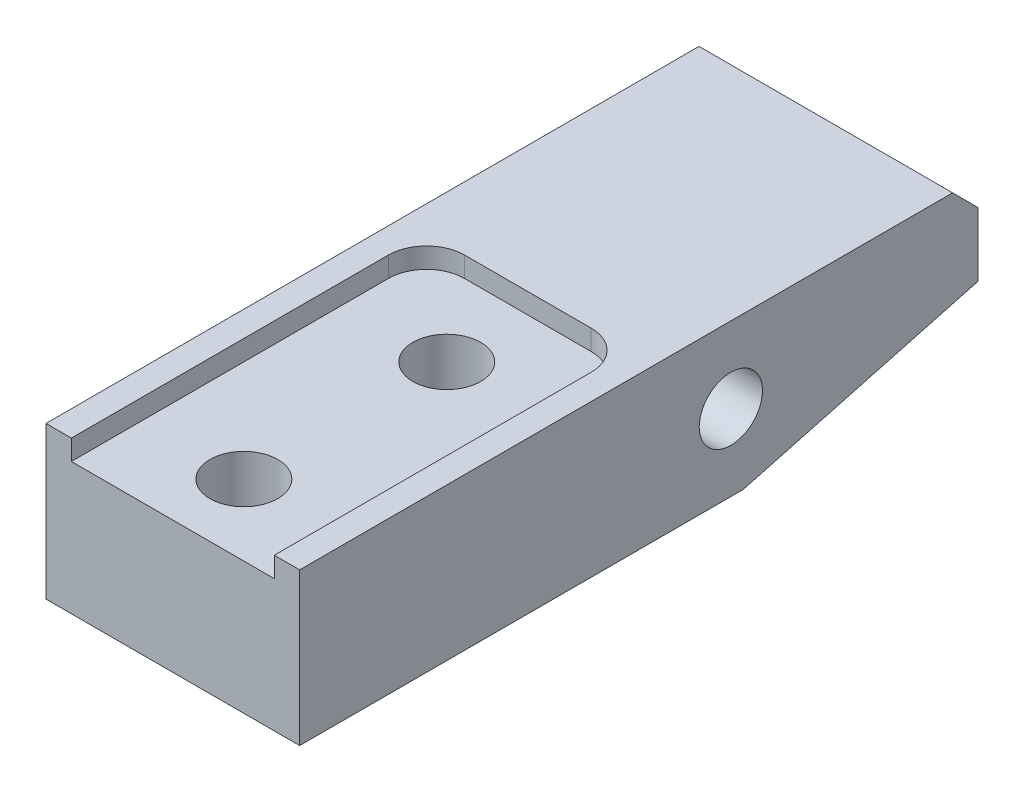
SolidWorks part; units mm, degrees
ref_plane "Front/Back" through (0, 0, 0) normal (0, 0, 1) x (1, 0, 0)
ref_plane "Top/Bottom" through (0, 0, 0) normal (0, 1, 0) x (1, 0, 0)
ref_plane "Right/Left" through (0, 0, 0) normal (1, 0, 0) x (0, 0, -1)
sketch "Sketch1" plane through (0, 0, 0) normal (0, 1, 0) x (1, 0, 0)
  line L0 (0, 0) -> (15.875, 0) construction
  line L1 (-15.875, 42.4561) -> (15.875, 42.4561)
  line L2 (-15.875, 42.4561) -> (-15.875, -42.4561)
  line L3 (-15.875, -42.4561) -> (15.875, -42.4561)
  line L4 (15.875, 42.4561) -> (15.875, -42.4561)
  line L5 (0, 0) -> (0, 42.4561) construction
  dimension "D1" = 31.75
  dimension "D2" = 84.9122
extrude "Extrude1" add sketch "Sketch1" along normal mid plane 19.05
sketch "Sketch2" plane through (0, 9.525, 0) normal (0, 1, 0) x (-1, 0, 0)
  line L0 (0, 0) -> (0, 47.0816) construction
  line L1 (0, 0) -> (18.9167, 0) construction
  line L2 (15.875, 42.4561) -> (-15.875, 42.4561) construction
  line L3 (-12.7, 42.4561) -> (12.7, 42.4561)
  line L4 (-12.7, 42.4561) -> (-12.7, -1.9939)
  line L5 (-12.7, -1.9939) -> (12.7, -1.9939)
  line L6 (12.7, 42.4561) -> (12.7, -1.9939)
  dimension "D1" = 25.4
  dimension "D2" = 44.45
extrude "(Key Pocket)" cut sketch "Sketch2" against normal blind 2.54
fillet "Fillet1" radius 4.7752 2 edges at (12.7, 8.255, -1.9939) (-12.7, 8.255, -1.9939)
hole_wizard "M10 X 1.5 Thru (Mount Holes)" positions "Sketch4" profile "Sketch3" tap size "M10x1.5" standard "Ansi Metric"
sketch "Sketch4" plane through (0, 6.985, 0) normal (0, 1, 0) x (-1, 0, 0)
  line L0 (0, 0) -> (0, 44.9974) construction
  line L1 (0, 0) -> (29.0657, 0) construction
  line L2 (12.7, 42.4561) -> (-12.7, 42.4561) construction
  point P0 (0, 8.1661)
  point P1 (0, 33.5661)
  dimension "D1" = 25.4
  dimension "D2" = 8.89
sketch "Sketch3" plane through (0, 6.985, 8.1661) normal (1, 0, 0) x (0, 0, 1)
  line L0 (0, 0) -> (0, 16.51)
  line L1 (0, 16.51) -> (4.25, 16.51)
  line L2 (4.25, 16.51) -> (4.25, 0)
  line L5 (4.25, 0) -> (0, 0)
  line L11 (0, -6.35) -> (0, 107.95) construction
  dimension "Thru Tap Drill Dia." = 8.5
  dimension "Thru Tap Drill Depth" = 16.51
sketch "Sketch6" plane through (-15.875, 0, 0) normal (-1, 0, 0) x (0, 0, 1)
  line L0 (0, 0) -> (45.1599, 0) construction
  line L1 (0, 0) -> (0, 18.5564) construction
  line L2 (42.4561, 9.525) -> (42.4561, -9.525) construction
  circle A0 centre (-11.5189, 0) radius 3.9624
  dimension "D1" = 7.9248
  dimension "D2" = 53.975
extrude "Cut-Extrude2" cut sketch "Sketch6" against normal through all
sketch "Sketch7" plane through (-15.875, 0, 0) normal (-1, 0, 0) x (0, 0, 1)
  line L0 (-13.0699, -9.525) -> (-42.4561, -1.651)
  line L1 (-42.4561, -9.525) -> (42.4561, -9.525) construction
  line L2 (-42.4561, 9.525) -> (-42.4561, -9.525) construction
  line L3 (-42.4561, -1.651) -> (-42.4561, -9.525)
  line L4 (-42.4561, -9.525) -> (-13.0699, -9.525)
  dimension "D1" = 11.176
  dimension "D2" = 15
extrude "Cut-Extrude3" cut sketch "Sketch7" against normal through all
chamfer "Chamfer1" distance 3.175 angle 45 1 edges at (0, 9.525, -42.4561)
